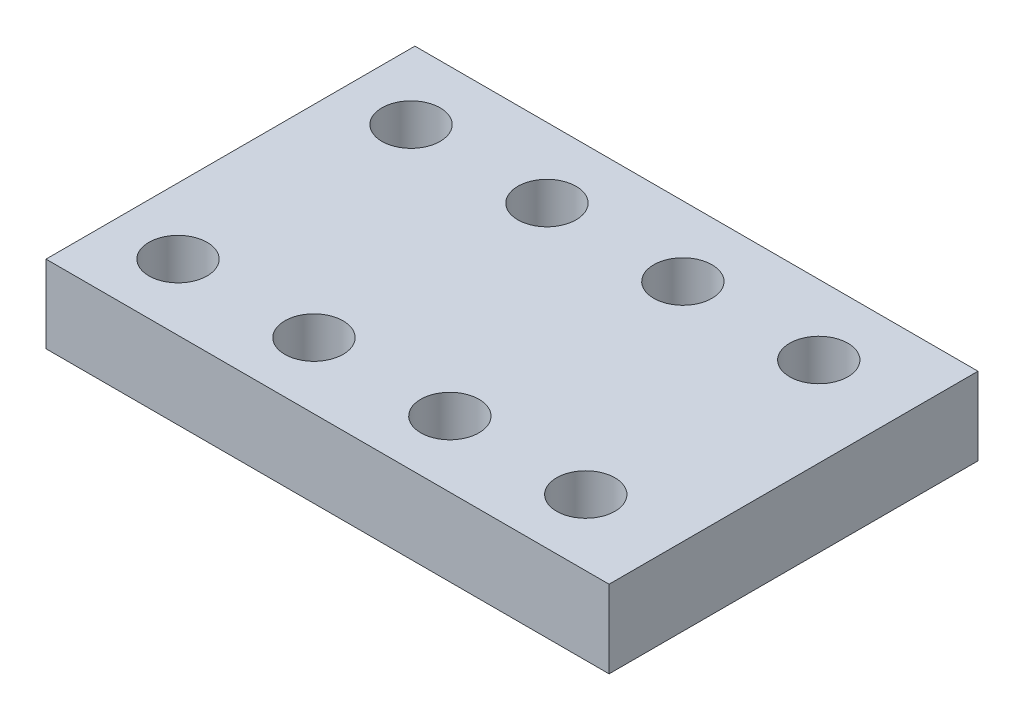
SolidWorks part; units mm, degrees
ref_plane "Front" through (0, 0, 0) normal (0, 0, 1) x (1, 0, 0)
ref_plane "Top" through (0, 0, 0) normal (0, 1, 0) x (1, 0, 0)
ref_plane "Right" through (0, 0, 0) normal (1, 0, 0) x (0, 0, -1)
sketch "Sketch1" plane through (0, 0, 0) normal (0, 1, 0) x (1, 0, 0)
  line L0 (72.5, -47.5) -> (-72.5, 47.5) construction
  line L1 (-72.5, 47.5) -> (72.5, 47.5)
  line L2 (-72.5, 47.5) -> (-72.5, -47.5)
  line L3 (-72.5, -47.5) -> (72.5, -47.5)
  line L4 (72.5, 47.5) -> (72.5, -47.5)
  dimension "D1" = 145
  dimension "D2" = 95
extrude "Extrude1" add sketch "Sketch1" along normal blind 20
sketch "Sketch2" plane through (0, 20, 0) normal (0, 1, 0) x (-1, 0, 0)
  line L0 (72.5, -47.5) -> (72.5, 47.5) construction
  line L1 (72.5, 47.5) -> (-72.5, 47.5) construction
  circle A0 centre (55.5, 30.5) radius 7.5
  dimension "D3" = 15
  dimension "D1" = 17
  dimension "D2" = 17
extrude "Cut-Extrude2" cut sketch "Sketch2" against normal through all
pattern_linear "LPattern2" count 4 spacing 35 along (1, 0, 0) count 2 spacing 60 along (0, 0, -1) of "Cut-Extrude2"
